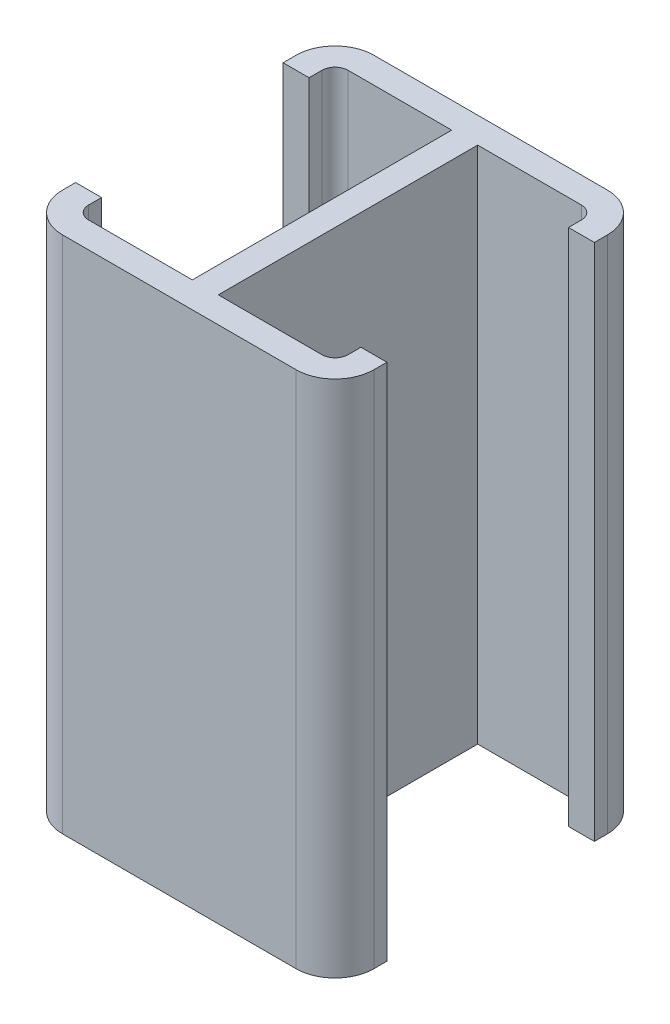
SolidWorks part; units mm, degrees
ref_plane "正面" through (0, 0, 0) normal (0, 0, 1) x (1, 0, 0)
ref_plane "平面" through (0, 0, 0) normal (0, 1, 0) x (1, 0, 0)
ref_plane "右側面" through (0, 0, 0) normal (1, 0, 0) x (0, 0, -1)
sketch "ｽｹｯﾁ1" plane through (0, 0, 0) normal (0, 1, 0) x (1, 0, 0)
  line L0 (0, 0) -> (0, -60)
  line L1 (0, -60) -> (60, -60)
  line L2 (60, -60) -> (60, -40)
  line L3 (60, -40) -> (50, -40)
  line L4 (50, -40) -> (50, -50)
  line L5 (50, -50) -> (5, -50)
  line L6 (5, -50) -> (5, 0)
  line L7 (5, 0) -> (0, 0)
extrude "ﾎﾞｽ - 押し出し1" add sketch "ｽｹｯﾁ1" along normal blind 200
fillet "ﾌｨﾚｯﾄ1" radius 15 1 edges at (60, 100, 60)
fillet "ﾌｨﾚｯﾄ2" radius 5 1 edges at (50, 100, 50)
mirror "ﾐﾗｰ1" about plane through (0, 200, 0) normal (1, 0, 0) of "ﾎﾞｽ - 押し出し1", "ﾌｨﾚｯﾄ1", "ﾌｨﾚｯﾄ2"
mirror "ﾐﾗｰ2" about plane through (5, 200, 0) normal (0, 0, 1) of "ﾎﾞｽ - 押し出し1", "ﾌｨﾚｯﾄ1", "ﾌｨﾚｯﾄ2", "ﾐﾗｰ1"
equation "\"C\"= 20"
equation "\"D3@ｽｹｯﾁ1\"=\"C\""
equation "\"B\" = 10"
equation "\"D4@ｽｹｯﾁ1\"=\"B\""
equation "\"D5@ｽｹｯﾁ1\"=\"B\""
equation "\"A\"= 10"
equation "\"D6@ｽｹｯﾁ1\"=\"A\"/2"
equation "\"D1@ﾌｨﾚｯﾄ1\"=\"B\"/2*3"
equation "\"D1@ﾌｨﾚｯﾄ2\"=\"B\"/2"
